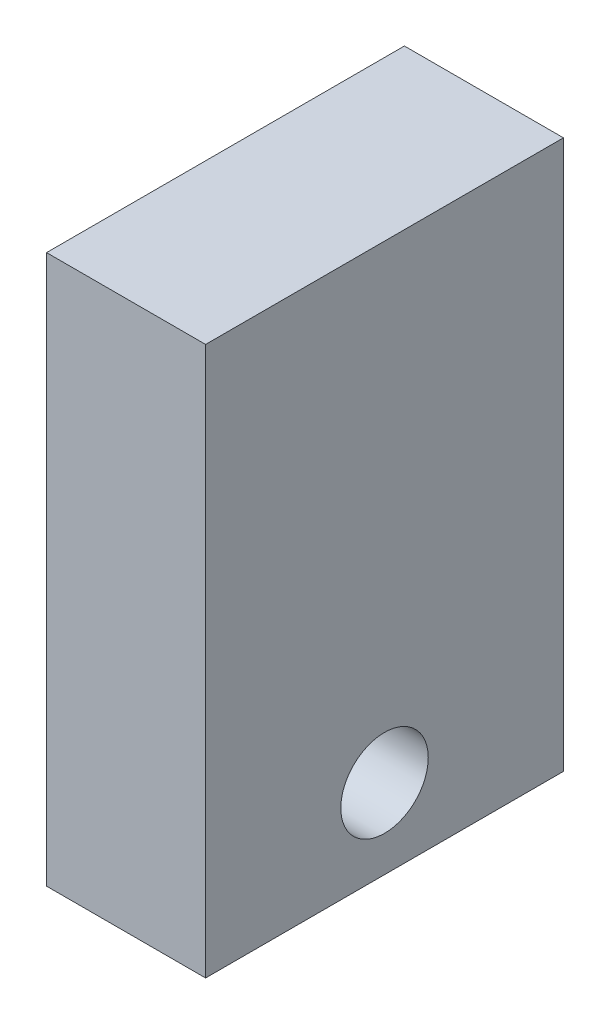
SolidWorks part; units mm, degrees
ref_plane "Plan de face" through (0, 0, 0) normal (0, 0, 1) x (1, 0, 0)
ref_plane "Plan de dessus" through (0, 0, 0) normal (0, 1, 0) x (1, 0, 0)
ref_plane "Plan de droite" through (0, 0, 0) normal (1, 0, 0) x (0, 0, -1)
sketch "Esquisse1" plane through (0, 0, -441.155) normal (0, 0, 1) x (1, 0, 0)
  line L1 (30, 301.4482) -> (70, 301.4482)
  line L2 (30, 301.4482) -> (30, 439.4482)
  line L3 (30, 439.4482) -> (70, 439.4482)
  line L4 (70, 301.4482) -> (70, 439.4482)
  line L5 (160, 439.4482) -> (40, 439.4482) construction
  line L6 (60, -1316.5) -> (60, 1316.5) construction
  line L8 (-10, 321.4482) -> (30, 321.4482) construction
  dimension "D1" = 20
  dimension "D2" = 40
  dimension "D3" = 10
extrude "Boss.-Extru.3" add sketch "Esquisse1" along normal up to surface (90 mm away)
hole_wizard "Dégagement M201" positions "Esquisse3" profile "Esquisse2" hole size "M20" standard "ISO"
sketch "Esquisse3" plane through (70, -86.2423, 21.5388) normal (-1, 0, 0) x (0, -1, 0)
  circle A0 centre (-407.6905, -417.6938) radius 9 construction
  point P0 (-407.6905, -417.6938)
sketch "Esquisse2" plane through (70, 321.4482, -396.155) normal (0, 1, 0) x (0, 0, -1)
  line L0 (0, 0) -> (0, 40)
  line L1 (0, 40) -> (11, 40)
  line L2 (11, 40) -> (11, 0)
  line L5 (11, 0) -> (0, 0)
  line L11 (0, -6.35) -> (0, 107.95) construction
  dimension "Diamètre du perçage jusqu'au prochain" = 22
  dimension "Profondeur du perçage jusqu'au prochain" = 40
